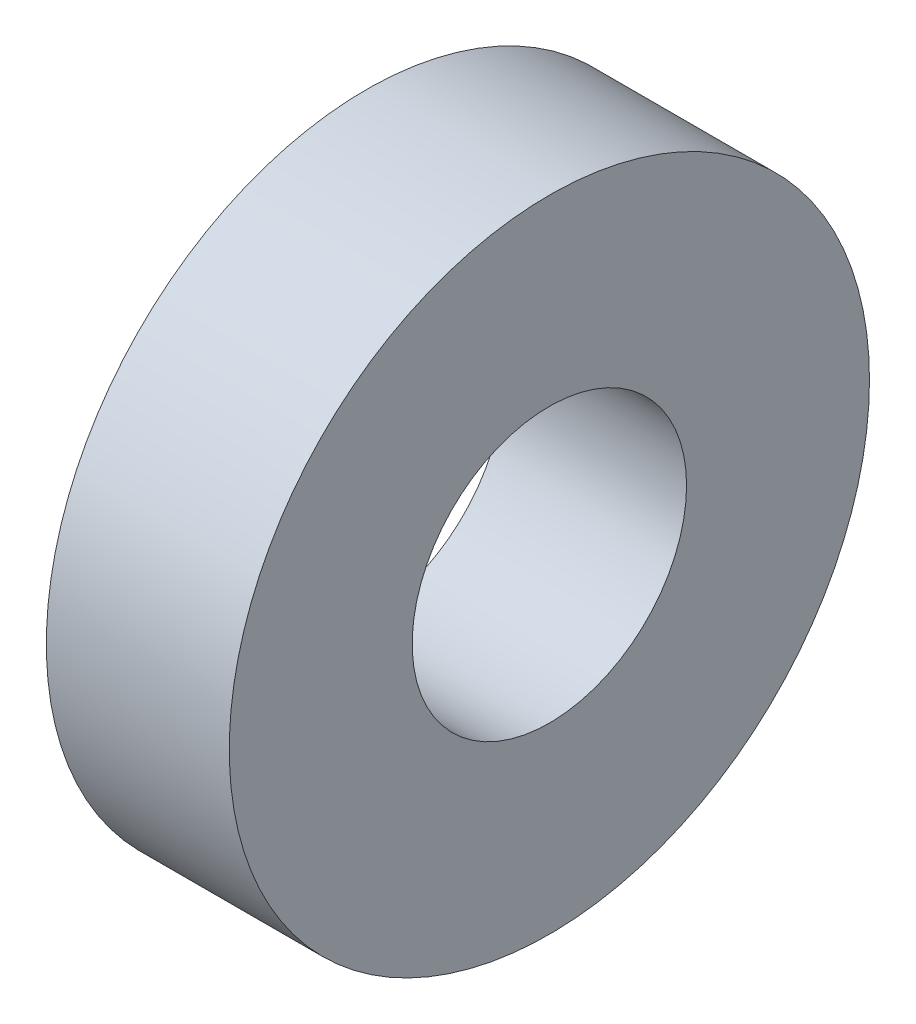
SolidWorks part; units mm, degrees
ref_plane "前视基准面" through (0, 0, 0) normal (0, 0, 1) x (1, 0, 0)
ref_plane "上视基准面" through (0, 0, 0) normal (0, 1, 0) x (1, 0, 0)
ref_plane "右视基准面" through (0, 0, 0) normal (1, 0, 0) x (0, 0, -1)
other "Configuration Table"
sketch "草图1" plane through (0, 0, 0) normal (1, 0, 0) x (0, 0, -1)
  circle A0 centre (0, 0) radius 3.5
  circle A1 centre (0, 0) radius 1.5
  dimension "D1" = 3
  dimension "D2" = 7
extrude "凸台-拉伸1" add sketch "草图1" along normal mid plane 2
